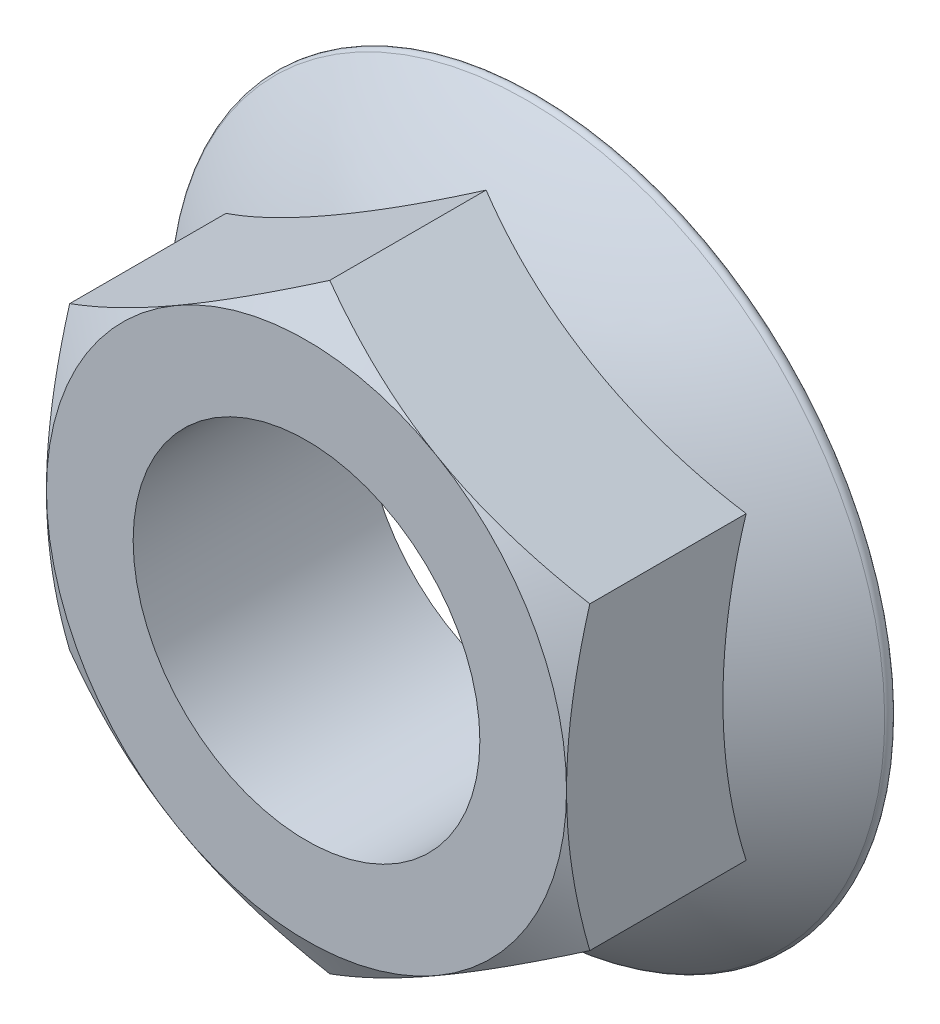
SolidWorks part; units mm, degrees
ref_plane "Front Plane" through (0, 0, 0) normal (0, 0, 1) x (1, 0, 0)
ref_plane "Top Plane" through (0, 0, 0) normal (0, 1, 0) x (1, 0, 0)
ref_plane "Right Plane" through (0, 0, 0) normal (1, 0, 0) x (0, 0, -1)
sketch "Sketch1" plane through (0, 0, 0) normal (0, 0, 1) x (1, 0, 0)
  line L1 (0, 25.9808) -> (-22.5, 12.9904)
  line L2 (-22.5, 12.9904) -> (-22.5, -12.9904)
  line L3 (-22.5, -12.9904) -> (0, -25.9808)
  line L4 (0, -25.9808) -> (22.5, -12.9904)
  line L5 (22.5, -12.9904) -> (22.5, 12.9904)
  line L6 (22.5, 12.9904) -> (0, 25.9808)
  circle A0 centre (0, 0) radius 22.5 construction
  dimension "D1" = 45
extrude "Boss-Extrude1" add sketch "Sketch1" along normal blind 20
sketch "Sketch2" plane through (0, 0, 0) normal (1, 0, 0) x (0, 0, -1)
  line L0 (0, 0) -> (-12, 0)
  line L1 (0, -30.5898) -> (0, 0)
  arc A0 (-12, 0) -> (-0.8855, -30.9082) centre (36.5334, 0) ccw
  arc A1 (-0.8855, -30.9082) -> (0, -30.5898) centre (-0.5, -30.5898) ccw
  point P7 (0, -31.95)
  dimension "D3" = 0.5
  dimension "D1" = 12
  dimension "D2" = 31.95
revolve "Revolve1" add sketch "Sketch2" angle 360 about L0
sketch "Sketch3" plane through (0, 0, 20) normal (0, 0, 1) x (1, 0, 0)
  circle A0 centre (0, 0) radius 22.5
extrude "Cut-Extrude1" cut sketch "Sketch3" against normal blind 20 draft 60 flip side to cut
sketch "Sketch4" plane through (0, 0, 20) normal (0, 0, 1) x (1, 0, 0)
  circle A0 centre (0, 0) radius 15
  dimension "D1" = 30
extrude "Cut-Extrude2" cut sketch "Sketch4" against normal through all
